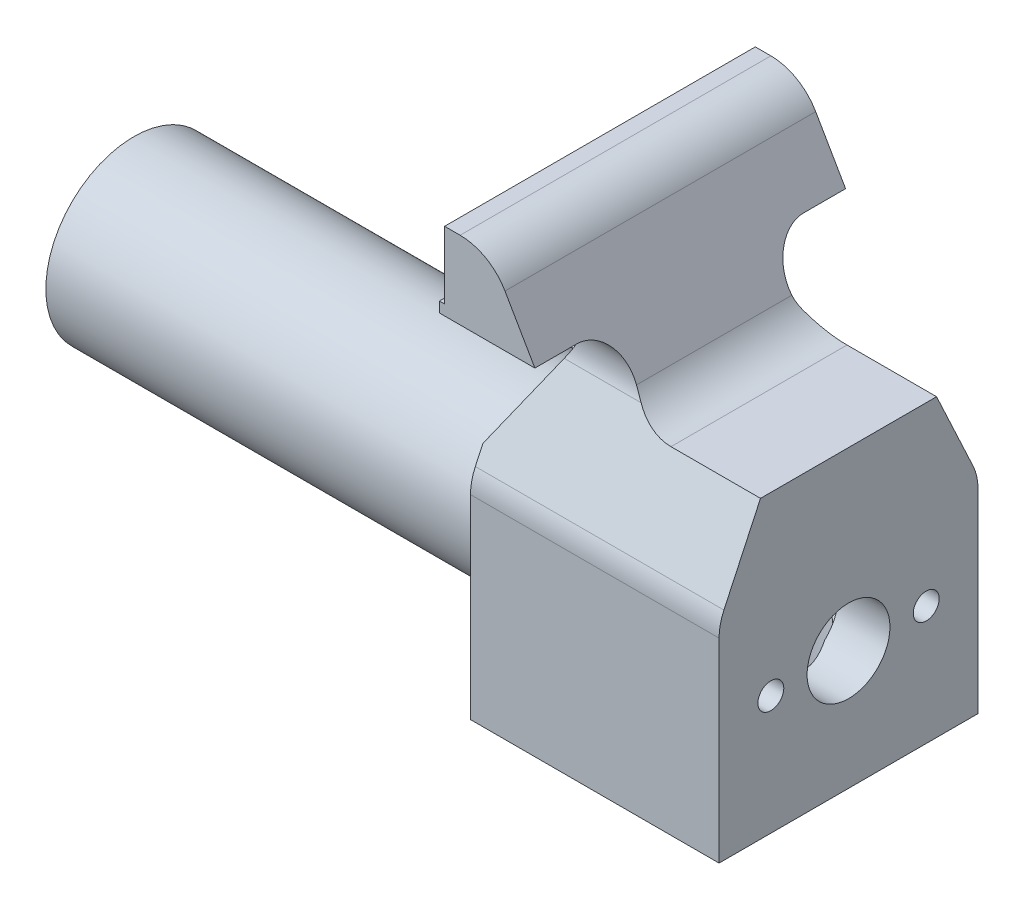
SolidWorks part; units mm, degrees
ref_plane "Front Plane" through (0, 0, 0) normal (0, 0, 1) x (1, 0, 0)
ref_plane "Top Plane" through (0, 0, 0) normal (0, 1, 0) x (1, 0, 0)
ref_plane "Right Plane" through (0, 0, 0) normal (1, 0, 0) x (0, 0, -1)
sketch "Sketch1" plane through (0, 0, 0) normal (1, 0, 0) x (0, 0, -1)
  line L0 (0, 0) -> (0, 62.5) construction
  line L1 (-24.0631, 41.8532) -> (-17, 57)
  line L3 (-25, 37.627) -> (-25, 0)
  line L4 (-25, 0) -> (25, 0)
  line L5 (25, 37.627) -> (25, 0)
  line L6 (-17, 57) -> (17, 57)
  line L7 (17, 57) -> (24.0631, 41.8532)
  arc A0 (24.0631, 41.8532) -> (25, 37.627) centre (15, 37.627) cw
  arc A1 (-24.0631, 41.8532) -> (-25, 37.627) centre (-15, 37.627) ccw
  point P15 (25, 39.8439)
  point P18 (-25, 39.8439)
  dimension "D5" = 10
  dimension "D1" = 50
  dimension "D2" = 34
  dimension "D3" = 25
  dimension "D4" = 57
extrude "Boss-Extrude1" add sketch "Sketch1" along normal blind 48
sketch "Sketch2" plane through (0, 0, 0) normal (0, 0, 1) x (1, 0, 0)
  line L0 (0, 57) -> (0, 85)
  line L1 (0, 85) -> (3, 85)
  line L2 (11.6603, 80) -> (24.9393, 57)
  line L3 (48, 57) -> (0, 57) construction
  line L4 (24.9393, 57) -> (0, 57)
  arc A0 (3, 85) -> (11.6603, 80) centre (3, 75) cw
  dimension "D3" = 10
  dimension "D1" = 28
  dimension "D2" = 120
  dimension "D4" = 3
extrude "Boss-Extrude2" add sketch "Sketch2" along normal mid plane 60
sketch "Sketch3" plane through (0, 0, 0) normal (0, 0, 1) x (1, 0, 0)
  line L0 (0, 70) -> (0, 45)
  line L1 (0, 85) -> (0, 57) construction
  line L2 (0, 57) -> (0, 41.8532) construction
  line L3 (0, 70) -> (5.7735, 70)
  line L5 (3, 85) -> (0, 85) construction
  line L6 (10.1036, 62.5) -> (0, 45)
  arc A0 (5.7735, 70) -> (10.1036, 62.5) centre (5.7735, 65) cw
  dimension "D4" = 5
  dimension "D1" = 40
  dimension "D2" = 15
  dimension "D3" = 30
extrude "Cut-Extrude1" cut sketch "Sketch3" against normal through all both and the other way through all
sketch "Sketch4" plane through (0, 0, 0) normal (-1, 0, 0) x (0, 0, 1)
  line L0 (-30, 70) -> (-30, 29.1214)
  line L1 (-30, 70) -> (-21.9258, 70)
  line L2 (-30, 70) -> (30, 70) construction
  line L3 (-15.5816, 60.0417) -> (-30, 29.1214)
  line L5 (-22.5957, 45) -> (-17, 57) construction
  arc A0 (-21.9258, 70) -> (-15.5816, 60.0417) centre (-21.9258, 63) cw
  dimension "D1" = 7
extrude "Cut-Extrude2" cut sketch "Sketch4" against normal through all
mirror "Mirror1" about plane through (0, 0, 0) normal (0, 0, 1) of "Cut-Extrude2"
sketch "Sketch5" plane through (0, 0, 0) normal (-1, 0, 0) x (0, 0, 1)
  line L0 (30, 85) -> (30, 70) construction
  line L1 (-30, 70) -> (30, 70)
  line L2 (-30, 70) -> (-30, 72)
  line L3 (-30, 72) -> (30, 72)
  line L4 (30, 70) -> (30, 72)
  dimension "D1" = 2
extrude "Boss-Extrude3" add sketch "Sketch5" along normal blind 1
sketch "Sketch6" plane through (0, 0, 0) normal (-1, 0, 0) x (0, 0, 1)
  line L0 (25, 0) -> (-25, 0) construction
  circle A0 centre (0, 23) radius 17
  dimension "D1" = 34
  dimension "D2" = 23
extrude "Boss-Extrude4" add sketch "Sketch6" along normal blind 90
sketch "Sketch7" plane through (-90, 0, 0) normal (-1, 0, 0) x (0, 0, 1)
  circle A0 centre (0, 23) radius 15
  dimension "D1" = 30
extrude "Cut-Extrude3" cut sketch "Sketch7" against normal blind 128
sketch "Sketch8" plane through (48, 0, 0) normal (1, 0, 0) x (0, 0, -1)
  circle A0 centre (0, 23) radius 8
  dimension "D1" = 16
extrude "Cut-Extrude4" cut sketch "Sketch8" against normal up to next
sketch "Sketch9" plane through (48, 0, 0) normal (1, 0, 0) x (0, 0, -1)
  line L0 (0, 23) -> (0, 43.9276) construction
  circle A0 centre (15, 23) radius 2.5
  circle A1 centre (-15, 23) radius 2.5
  dimension "D1" = 5
  dimension "D2" = 30
extrude "Cut-Extrude5" cut sketch "Sketch9" against normal blind 5
sketch "Sketch10" plane through (0, 0, 0) normal (0, -1, 0) x (1, 0, 0)
  line L0 (0, 25) -> (0, -25) construction
  circle A0 centre (24, 0) radius 15
  dimension "D1" = 30
  dimension "D2" = 24
extrude "Cut-Extrude6" cut sketch "Sketch10" against normal up to next
sketch "Sketch11" plane through (0, 0, 0) normal (-1, 0, 0) x (0, 0, 1)
  line L0 (0, 23) -> (0, 87.7635) construction
  line L1 (30, 85) -> (-30, 85) construction
  circle A0 centre (-18, 79) radius 1.5
  circle A1 centre (18, 79) radius 1.5
  dimension "D1" = 3
  dimension "D2" = 36
  dimension "D3" = 6
extrude "Cut-Extrude7" cut sketch "Sketch11" against normal blind 5
fillet "Fillet1" radius 10 1 edges at (24.9393, 57, 0)
